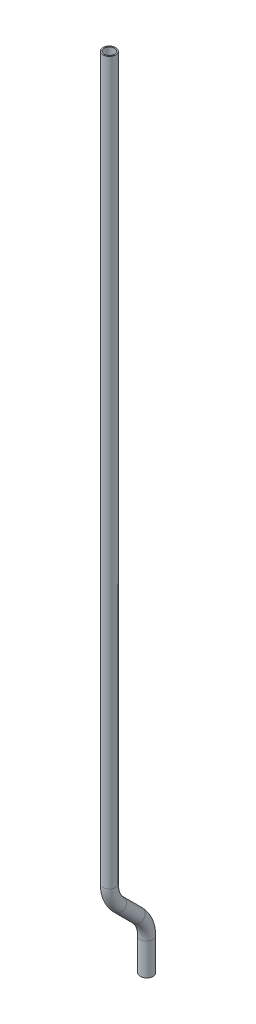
SolidWorks part; units mm, degrees
ref_plane "Front Plane" through (0, 0, 0) normal (0, 0, 1) x (1, 0, 0)
ref_plane "Top Plane" through (0, 0, 0) normal (0, 1, 0) x (1, 0, 0)
ref_plane "Right Plane" through (0, 0, 0) normal (1, 0, 0) x (0, 0, -1)
sketch "Sketch1" plane through (0, 0, 0) normal (1, 0, 0) x (0, 0, -1)
  line L0 (0, 0) -> (0, 23.8125)
  line L1 (-6.9745, 40.6505) -> (-20.9655, 54.6414)
  line L2 (-27.94, 71.4794) -> (-27.94, 609.6)
  arc A0 (0, 23.8125) -> (-6.9745, 40.6505) centre (-23.8125, 23.8125) ccw
  arc A1 (-20.9655, 54.6414) -> (-27.94, 71.4794) centre (-4.1275, 71.4794) cw
  point P7 (0, 33.676)
  dimension "D5" = 23.8125
  dimension "D1" = 23.8125
  dimension "D2" = 27.94
  dimension "D3" = 135
  dimension "D4" = 609.6
sketch "Sketch2" plane through (0, 0, 0) normal (0, 1, 0) x (1, 0, 0)
  circle A0 centre (0, 0) radius 3.8735
  circle A1 centre (0, 0) radius 4.7625
  dimension "D1" = 0.889
  dimension "D2" = 9.525
sweep "Sweep1" add profiles "Sketch2" path "Sketch1"
